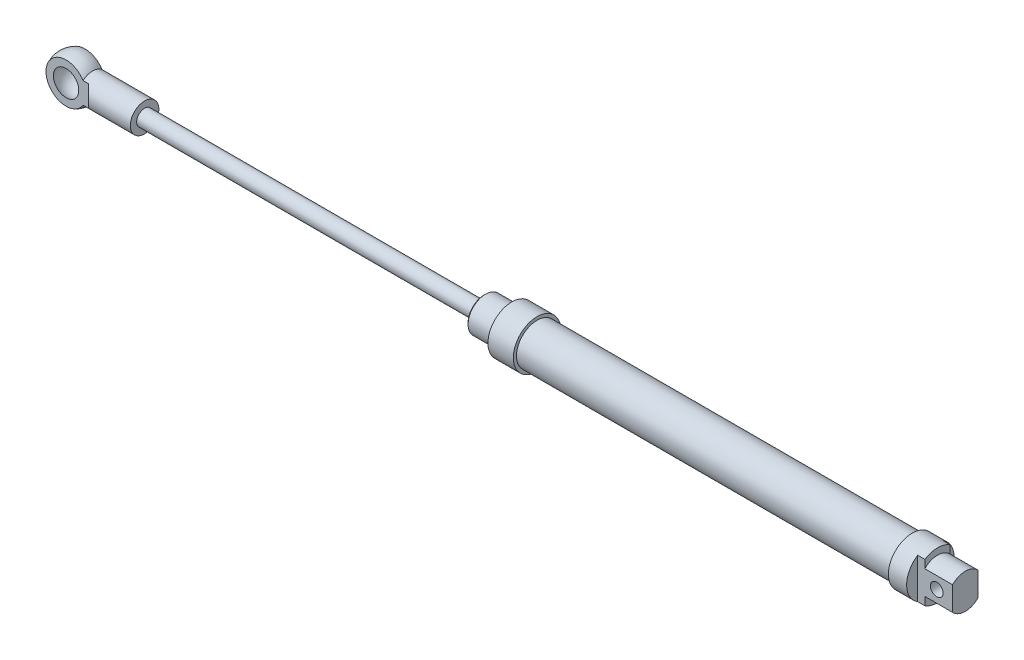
SolidWorks part; units mm, degrees
ref_plane "Face" through (0, 0, 0) normal (0, 0, 1) x (1, 0, 0)
ref_plane "Dessus" through (0, 0, 0) normal (0, 1, 0) x (1, 0, 0)
ref_plane "Droite" through (0, 0, 0) normal (1, 0, 0) x (0, 0, -1)
sketch "Esquisse1" plane through (0, 0, 0) normal (0, 0, 1) x (1, 0, 0)
  line L0 (-97.004, 0) -> (95.1168, 0) construction
  line L1 (0, 5) -> (0, 11)
  line L2 (0, 11) -> (17.5, 11)
  line L3 (17.5, 11) -> (17.5, 15)
  line L4 (17.5, 15) -> (33.5, 15)
  line L5 (33.5, 15) -> (33.5, 13)
  line L6 (33.5, 13) -> (270, 13)
  line L7 (270, 13) -> (270, 15)
  line L8 (270, 15) -> (286, 15)
  line L10 (0, 5) -> (-214.5, 5)
  line L11 (-214.5, 5) -> (-214.5, 0)
  line L12 (303.5, 0) -> (-214.5, 0)
  line L14 (286, 15) -> (286, 11)
  line L15 (286, 11) -> (303.5, 11)
  line L16 (303.5, 11) -> (303.5, 0)
  dimension "D1" = 10
  dimension "D2" = 22
  dimension "D3" = 30
  dimension "D4" = 26
  dimension "D5" = 11
  dimension "D6" = 16
  dimension "D7" = 17.5
  dimension "D8" = 236.5
  dimension "D9" = 214.5
  dimension "D10" = 17.5
  dimension "D11" = 33.5
revolve "Révolution1" add sketch "Esquisse1" angle 360 about L12
sketch "Esquisse2" plane through (0, 0, 0) normal (0, 1, 0) x (1, 0, 0)
  line L0 (303.5, 0) -> (260.4523, 0) construction
  line L1 (281.5, 18.8959) -> (305.7924, 18.8959)
  line L2 (281.5, 18.8959) -> (281.5, 8)
  line L3 (281.5, 8) -> (305.7924, 8)
  line L4 (305.7924, 18.8959) -> (305.7924, 8)
  line L5 (305.7924, -18.8959) -> (305.7924, -8)
  line L6 (281.5, -8) -> (305.7924, -8)
  line L7 (281.5, -18.8959) -> (281.5, -8)
  line L8 (281.5, -18.8959) -> (305.7924, -18.8959)
  line L9 (303.5, -11) -> (303.5, 11) construction
  dimension "D1" = 8
  dimension "D3" = 22
extrude "Enlèv. mat.-Extru.1" cut sketch "Esquisse2" against normal mid plane 30
sketch "Esquisse3" plane through (0, 0, 8) normal (0, 0, 1) x (1, 0, 0)
  line L0 (303.5, -7.5498) -> (303.5, 7.5498) construction
  circle A0 centre (293.5, 0) radius 4
  dimension "D1" = 8
  dimension "D2" = 10
extrude "Enlèv. mat.-Extru.2" cut sketch "Esquisse3" against normal through all
sketch "Esquisse4" plane through (0, 0, 0) normal (0, 0, 1) x (1, 0, 0)
  line L0 (-199.4149, 0) -> (-244.0603, 0) construction
  line L2 (-246.7762, 9) -> (-214, 9)
  line L3 (-214.5, 5) -> (-214.5, -5) construction
  line L5 (-214, 9) -> (-214, 0)
  line L6 (-214, 0) -> (-271.5, 0)
  arc A0 (-246.7762, 9) -> (-271.5, 0) centre (-257.5, 0) ccw
  dimension "D4" = 28
  dimension "D2" = 43
  dimension "D3" = 9
  dimension "D5" = 0.5
revolve "Révolution3" add sketch "Esquisse4" angle 360 about L0
sketch "Esquisse5" plane through (0, 0, 0) normal (0, 1, 0) x (1, 0, 0)
  line L0 (-231.5883, 0) -> (-280.354, 0) construction
  line L1 (-277.5495, 6) -> (-243.4, 6)
  line L2 (-243.4, 6) -> (-236.545, 12.855)
  line L3 (-236.545, 12.855) -> (-236.545, 18.1585)
  line L4 (-236.545, 18.1585) -> (-277.5495, 16.8947)
  line L5 (-277.5495, 16.8947) -> (-277.5495, 6)
  line L6 (-277.5495, -16.8947) -> (-277.5495, -6)
  line L7 (-236.545, -18.1585) -> (-277.5495, -16.8947)
  line L8 (-236.545, -12.855) -> (-236.545, -18.1585)
  line L9 (-243.4, -6) -> (-236.545, -12.855)
  line L10 (-277.5495, -6) -> (-243.4, -6)
  arc A0 (-246.7762, 9) -> (-246.7762, -9) centre (-257.5, 0) ccw construction
  dimension "D3" = 28.1
  dimension "D1" = 135
  dimension "D2" = 6
extrude "Enlèv. mat.-Extru.3" cut sketch "Esquisse5" against normal mid plane 30
sketch "Esquisse6" plane through (0, 0, 0) normal (0, 0, 1) x (1, 0, 0)
  line L0 (-244.9874, 0) -> (-275.8779, 0) construction
  line L1 (-267.5, 0) -> (-247.5, 0)
  arc A0 (-247.5, 0) -> (-267.5, 0) centre (-257.5, 0) ccw
  arc A1 (-246.7762, 9) -> (-246.7762, -9) centre (-257.5, 0) ccw construction
  dimension "D1" = 20
revolve "Enlèvement de matière-Révolution1" cut sketch "Esquisse6" angle 360 about L0
chamfer "Chanfrein1" distance 1 angle 45 1 edges at (0, 11, 0)
